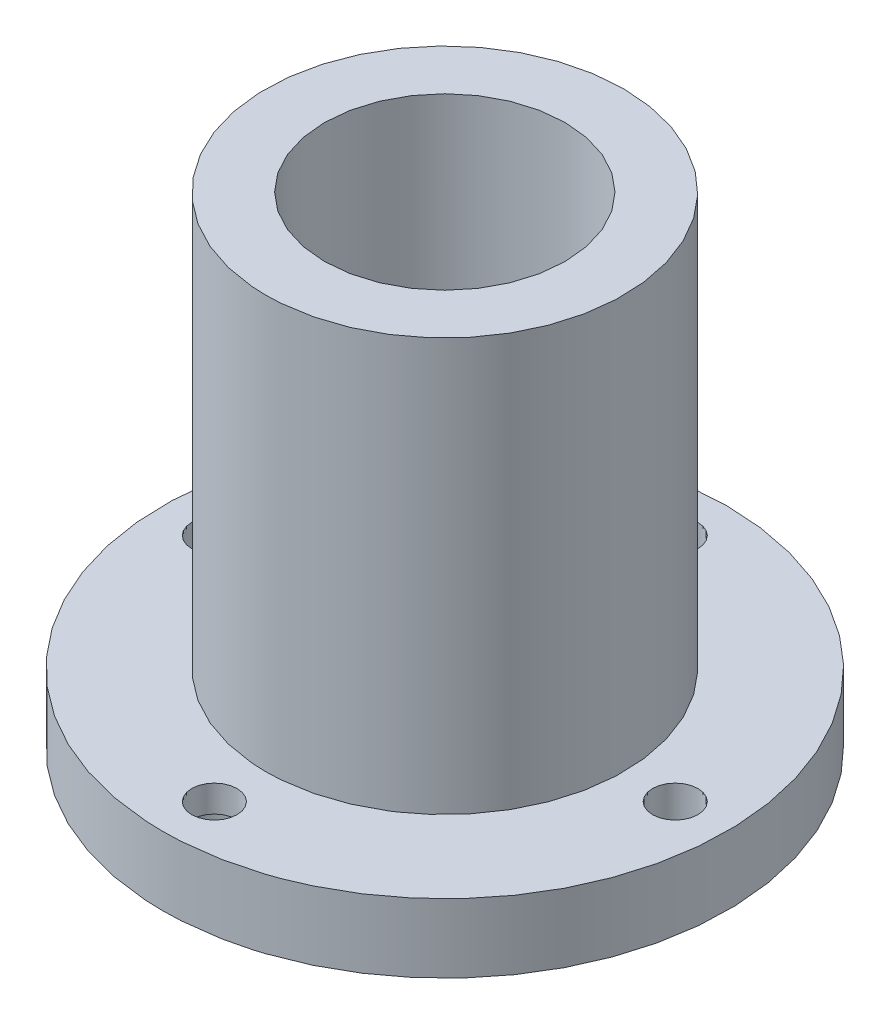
SolidWorks part; units mm, degrees
other "Solid2"
ref_plane "Front Plane" through (0, 0, 0) normal (0, 0, 1) x (1, 0, 0)
ref_plane "Top Plane" through (0, 0, 0) normal (0, 1, 0) x (1, 0, 0)
ref_plane "Right Plane" through (0, 0, 0) normal (1, 0, 0) x (0, 0, -1)
imported_body "2.7039 LMF35UU.stp<1>"
move or copy body "Body-Move/Copy1" bodies to move or copy 101 copy no rotation origin (35, 0, 0) rotation axis (0, 0, 1) rotation angle 90
